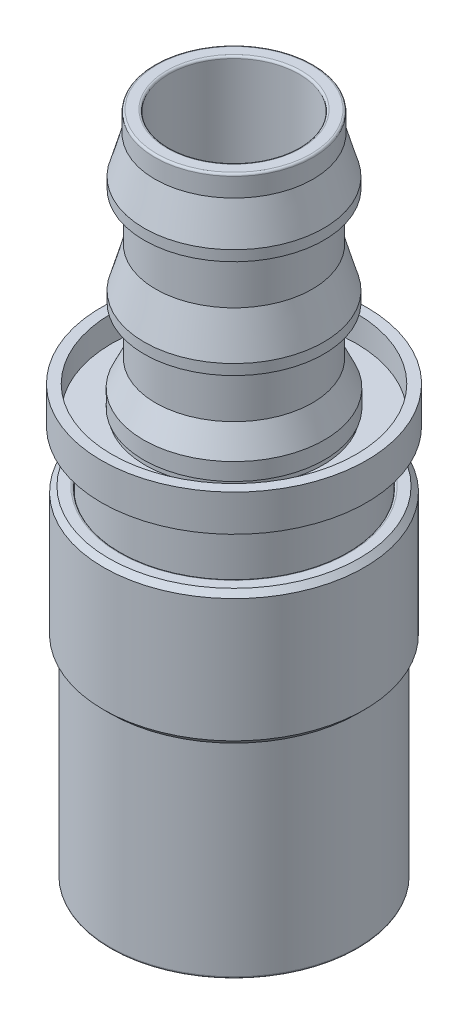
SolidWorks part; units mm, degrees
other "BODY_"
ref_plane "Front Plane" through (0, 0, 0) normal (0, 0, 1) x (1, 0, 0)
ref_plane "Top Plane" through (0, 0, 0) normal (0, 1, 0) x (1, 0, 0)
ref_plane "Right Plane" through (0, 0, 0) normal (1, 0, 0) x (0, 0, -1)
imported_body "SLEEVE"
imported_body "SC200S"
imported_body "BARB"
imported_body "PL-BARB"
sketch "Sketch1" plane through (0, 0, 0) normal (0, 0, 1) x (1, 0, 0)
  line L0 (-10.16, 17.1958) -> (-10.16, 1.016)
  line L1 (-10.16, 1.016) -> (-7.9375, 3.2385)
  line L2 (-7.9375, 3.2385) -> (-7.9375, 14.9733)
  line L3 (-7.9375, 14.9733) -> (-10.16, 17.1958)
  line L4 (0, 12.5443) -> (0, -2.2232) construction
  line L5 (0, 17.1958) -> (0, 1.016) construction
  line L7 (-10.668, 17.7038) -> (-10.16, 17.1958) construction
  line L8 (-10.16, 1.016) -> (-11.176, 0) construction
  dimension "D1" = 15.875
revolve "Revolve1" add sketch "Sketch1" angle 360 about L4
sketch "Sketch2" plane through (0, 0, 0) normal (0, -1, 0) x (1, 0, 0)
  line L1 (9.652, -5.5726) -> (9.652, 5.5726)
  line L2 (9.652, 5.5726) -> (0, 11.1452)
  line L3 (0, 11.1452) -> (-9.652, 5.5726)
  line L4 (-9.652, 5.5726) -> (-9.652, -5.5726)
  line L5 (-9.652, -5.5726) -> (0, -11.1452)
  line L6 (0, -11.1452) -> (9.652, -5.5726)
  circle A0 centre (0, 0) radius 9.652 construction
  dimension "D1" = 19.304
extrude "Cut-Extrude1" cut sketch "Sketch2" against normal up to surface (18.181 mm away)
